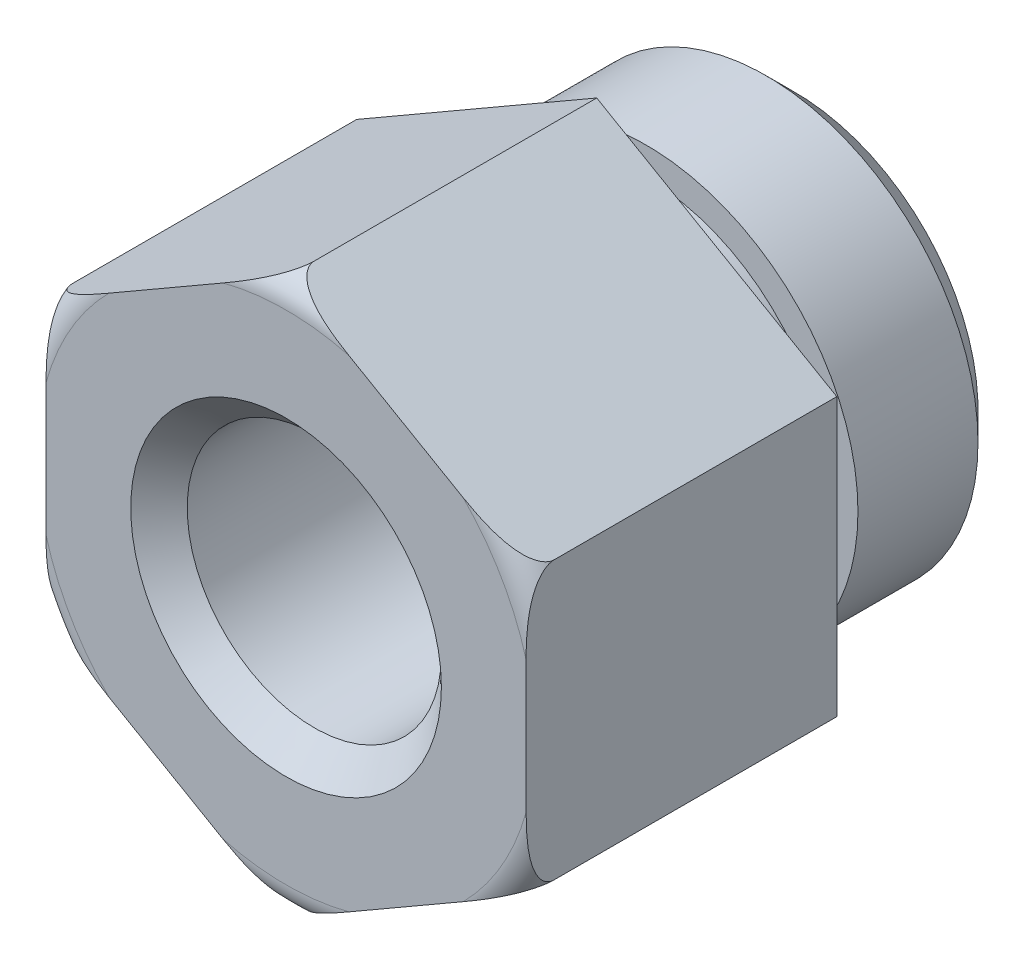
SolidWorks part; units mm, degrees
ref_plane "Plane1" through (0, 0, 0) normal (0, 0, 1) x (1, 0, 0)
ref_plane "Plane2" through (0, 0, 0) normal (0, 1, 0) x (-1, 0, 0)
ref_plane "Plane3" through (0, 0, 0) normal (1, 0, 0) x (0, 0, -1)
sketch "Head Sketch" plane through (0, 0, 0) normal (0, 0, 1) x (1, 0, 0)
  line L0 (0, 19.6299) -> (17, 9.815)
  line L1 (17, 9.815) -> (17, -9.815)
  line L2 (17, -9.815) -> (0, -19.6299)
  line L3 (0, -19.6299) -> (-17, -9.815)
  line L4 (-17, -9.815) -> (-17, 9.815)
  line L5 (-17, 9.815) -> (0, 19.6299)
  line L6 (17, 9.815) -> (-17, -9.815) construction
  line L7 (0, 19.6299) -> (0, -19.6299) construction
  line L8 (-17, 9.815) -> (17, -9.815) construction
  point P0 (0, 0)
  dimension "D1" = 60
  dimension "D2" = 60
  dimension "Width across flats" = 34
extrude "Tete" add sketch "Head Sketch" along normal blind 22
sketch "Sketch5" plane through (0, 0, 0) normal (1, 0, 0) x (0, 0, -1)
  line L0 (-22, -17.6299) -> (-22, -19.6299)
  line L1 (-22, -19.6299) -> (-20, -19.6299)
  line L2 (-22, -19.6299) -> (0, -19.6299) construction
  line L3 (-22, -19.6299) -> (-22, -9.815) construction
  line L5 (-15.0856, 0) -> (-8.1394, 0) construction
  line L6 (50, 0) -> (-50, 0) construction
  arc A0 (-22, -17.6299) -> (-20, -19.6299) centre (-20, -17.6299) ccw
  dimension "D1" = 2
revolve "Head Trim" cut sketch "Sketch5" angle 360 about L5
sketch "Esquisse2" plane through (0, 0, 0) normal (1, 0, 0) x (0, 0, -1)
  line L0 (0, 0) -> (21.9115, 0) construction
  line L1 (0, 9.815) -> (0, -9.815) construction
  line L2 (0, 13) -> (3.5, 13)
  line L3 (0, 19.6299) -> (0, 9.815) construction
  line L4 (3.5, 13) -> (3.5, 15)
  line L5 (3.5, 15) -> (14, 15)
  line L6 (14, 15) -> (14, 0)
  line L7 (0, 13) -> (0, 0)
  line L8 (0, 0) -> (14, 0)
  dimension "D1" = 15
  dimension "D2" = 14
  dimension "D3" = 3.5
  dimension "D4" = 13
revolve "Boss.-Révol.1" add sketch "Esquisse2"
chamfer "Chanfrein1" distance 2 angle 45 1 edges at (15, 0, -14)
sketch "Esquisse4" plane through (0, 0, 22) normal (0, 0, 1) x (1, 0, 0)
  circle A0 centre (0, 0) radius 9
  dimension "D1" = 18
extrude "Enlèv. mat.-Extru.1" cut sketch "Esquisse4" against normal blind 15
chamfer "Chanfrein3" distance 2 angle 45 1 edges at (9, 0, 22)
extrude "Enlèv. mat.-Extru.2" cut sketch "Esquisse5" against normal blind 4
sketch "Esquisse5" plane through (0, 0, 7) normal (0, 0, 1) x (1, 0, 0)
  circle A0 centre (0, 0) radius 11.5
  dimension "D1" = 23
sketch "Esquisse7" plane through (0, 0, -14) normal (0, 0, -1) x (-1, 0, 0)
  circle A0 centre (0, 0) radius 6
  dimension "D1" = 12
extrude "Enlèv. mat.-Extru.3" cut sketch "Esquisse7" against normal through all
